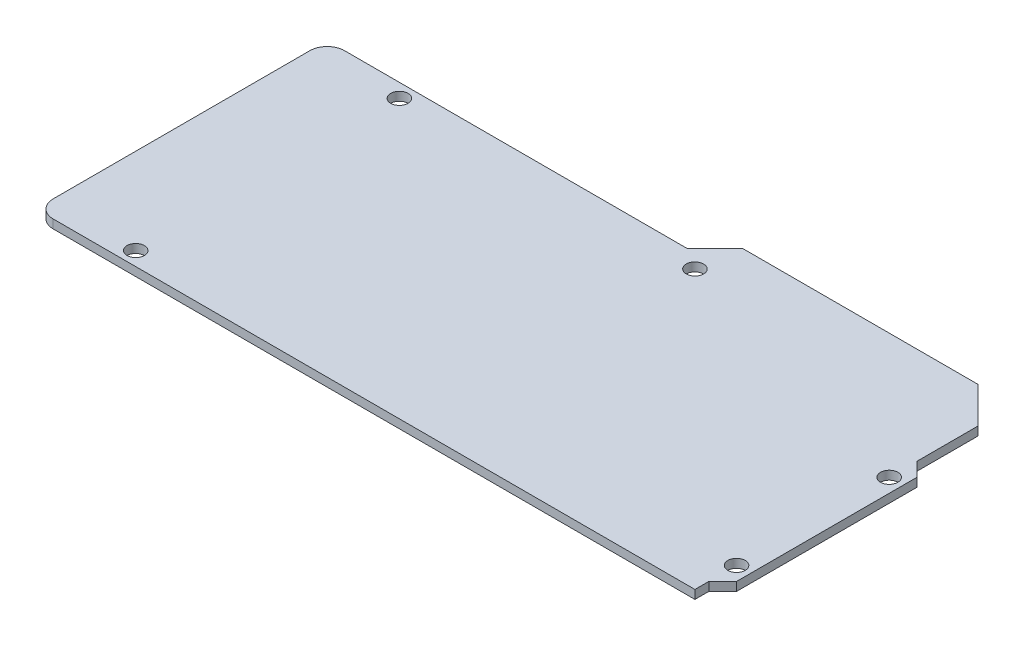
SolidWorks part; units mm, degrees
ref_plane "Front Plane" through (0, 0, 0) normal (0, 0, 1) x (1, 0, 0)
ref_plane "Top Plane" through (0, 0, 0) normal (0, 1, 0) x (1, 0, 0)
ref_plane "Right Plane" through (0, 0, 0) normal (1, 0, 0) x (0, 0, -1)
sketch "Sketch1" plane through (0, 0, 0) normal (0, 1, 0) x (1, 0, 0)
  line L0 (120.65, 2.54) -> (123.19, 5.08)
  line L1 (3.175, 0) -> (120.65, 0)
  line L2 (0, 3.175) -> (0, 50.165)
  line L3 (3.175, 53.34) -> (65.913, 53.34)
  line L4 (120.65, 0) -> (120.65, 2.54)
  line L5 (123.19, 5.08) -> (123.19, 38.1)
  line L6 (123.19, 38.1) -> (120.65, 40.64)
  line L7 (120.65, 51.816) -> (114.046, 58.42)
  line L8 (114.046, 58.42) -> (70.993, 58.42)
  line L9 (70.993, 58.42) -> (65.913, 53.34)
  line L10 (120.65, 40.64) -> (120.65, 51.816)
  arc A0 (3.175, 0) -> (0, 3.175) centre (3.175, 3.175) cw
  arc A1 (0, 50.165) -> (3.175, 53.34) centre (3.175, 50.165) cw
  point P14 (0, 0)
  point P17 (0, 53.34)
  dimension "D7" = 3.175
  dimension "D1" = 120.65
  dimension "D2" = 53.34
  dimension "D3" = 5.08
  dimension "D4" = 2.54
  dimension "D5" = 43.053
  dimension "D6" = 6.604
  dimension "D8" = 2.54
  dimension "D9" = 33.02
  dimension "D10" = 5.08
  dimension "D11" = 6.604
extrude "Boss-Extrude1" add sketch "Sketch1" along normal blind 1.5875
hole_wizard "1/8 (0.125) Diameter Hole1" positions "3DSketch1" profile "Sketch2" hole size "1/8" standard "Ansi Inch"
sketch3d "3DSketch1"
  line L0 (15.748, 1.5875, -50.8) -> (15.748, 1.5875, -2.54) construction
  line L1 (15.748, 1.5875, -50.8) -> (69.85, 1.5875, -50.8) construction
  line L3 (120.65, 1.5875, -35.56) -> (120.65, 1.5875, -7.62) construction
  line L5 (65.913, 1.5875, -53.34) -> (3.175, 1.5875, -53.34) construction
  line L6 (3.175, 1.5875, 0) -> (120.65, 1.5875, 0) construction
  line L7 (120.65, 1.5875, -40.64) -> (120.65, 1.5875, -51.816) construction
  line L8 (0, 1.5875, -50.165) -> (0, 1.5875, -3.175) construction
  point P0 (15.748, 1.5875, -50.8)
  point P2 (15.748, 1.5875, -2.54)
  point P4 (69.85, 1.5875, -50.8)
  point P6 (120.65, 1.5875, -35.56)
  point P8 (120.65, 1.5875, -7.62)
  dimension "D1" = 2.54
  dimension "D2" = 2.54
  dimension "D3" = 15.748
  dimension "D4" = 69.85
  dimension "D5" = 27.94
  dimension "D6" = 7.62
sketch "Sketch2" plane through (15.748, 1.5875, -50.8) normal (1, 0, 0) x (0, 0, 1)
  line L0 (0, 0) -> (0, 1.5875)
  line L1 (0, 1.5875) -> (1.5875, 1.5875)
  line L2 (1.5875, 1.5875) -> (1.5875, 0)
  line L5 (1.5875, 0) -> (0, 0)
  line L11 (0, -6.35) -> (0, 107.95) construction
  dimension "Thru Hole Dia." = 3.175
  dimension "Thru Hole Depth" = 1.5875
